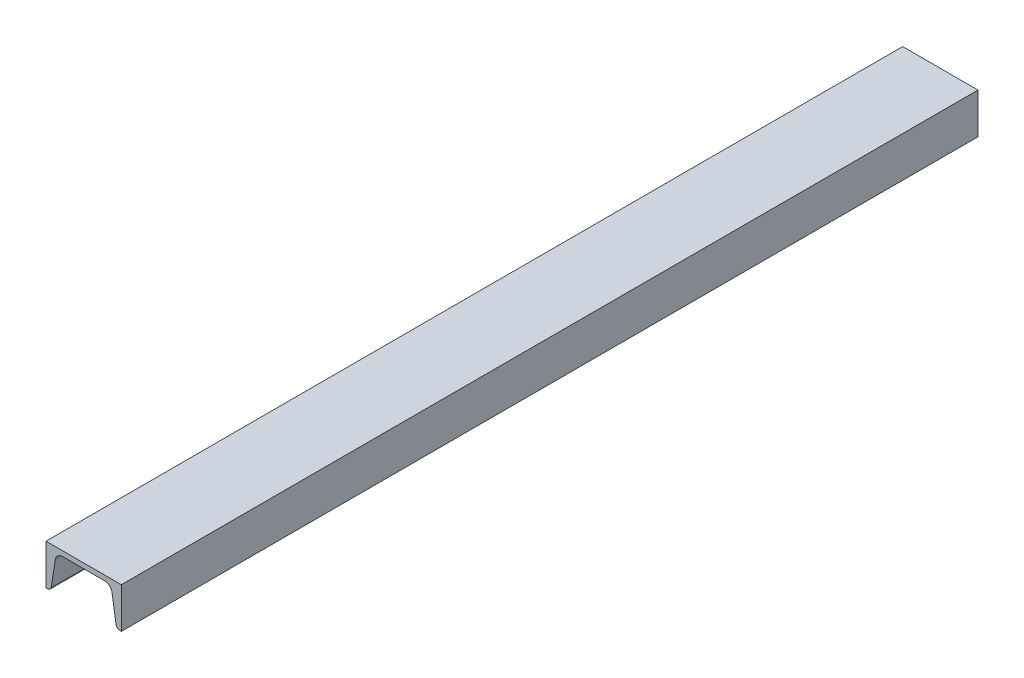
SolidWorks part; units mm, degrees
ref_plane "前视基准面" through (0, 0, 0) normal (0, 0, 1) x (1, 0, 0)
ref_plane "上视基准面" through (0, 0, 0) normal (0, 1, 0) x (1, 0, 0)
ref_plane "右视基准面" through (0, 0, 0) normal (1, 0, 0) x (0, 0, -1)
sketch "草图1" plane through (0, 0, 0) normal (0, 0, 1) x (1, 0, 0)
  line L0 (-40, 0) -> (40, 0)
  line L1 (40, 0) -> (40, -43)
  line L2 (40, -43) -> (38.418, -43)
  line L3 (-30.1135, -12.0523) -> (-34.4669, -39.6239)
  line L4 (22.2114, -5.3) -> (-22.2114, -5.3)
  line L5 (30.1135, -12.0523) -> (34.4669, -39.6239)
  line L6 (-38.418, -43) -> (-40, -43)
  line L7 (-40, -43) -> (-40, 0)
  line L8 (-40, -24) -> (-32, -24) construction
  line L9 (32, -24) -> (40, -24) construction
  arc A0 (-22.2114, -5.3) -> (-30.1135, -12.0523) centre (-22.2114, -13.3) ccw
  arc A1 (30.1135, -12.0523) -> (22.2114, -5.3) centre (22.2114, -13.3) ccw
  arc A2 (-34.4669, -39.6239) -> (-38.418, -43) centre (-38.418, -39) cw
  arc A3 (38.418, -43) -> (34.4669, -39.6239) centre (38.418, -39) cw
  point P19 (-35, -43)
  point P22 (35, -43)
  dimension "D10" = 8
  dimension "D11" = 4
  dimension "D1" = 5
  dimension "D2" = 5
  dimension "D3" = 80
  dimension "D4" = 43
  dimension "D5" = 5.3
  dimension "D6" = 40
  dimension "D7" = 19
  dimension "D8" = 8
  dimension "D9" = 8
extrude "拉伸1" add sketch "草图1" along normal blind 910
